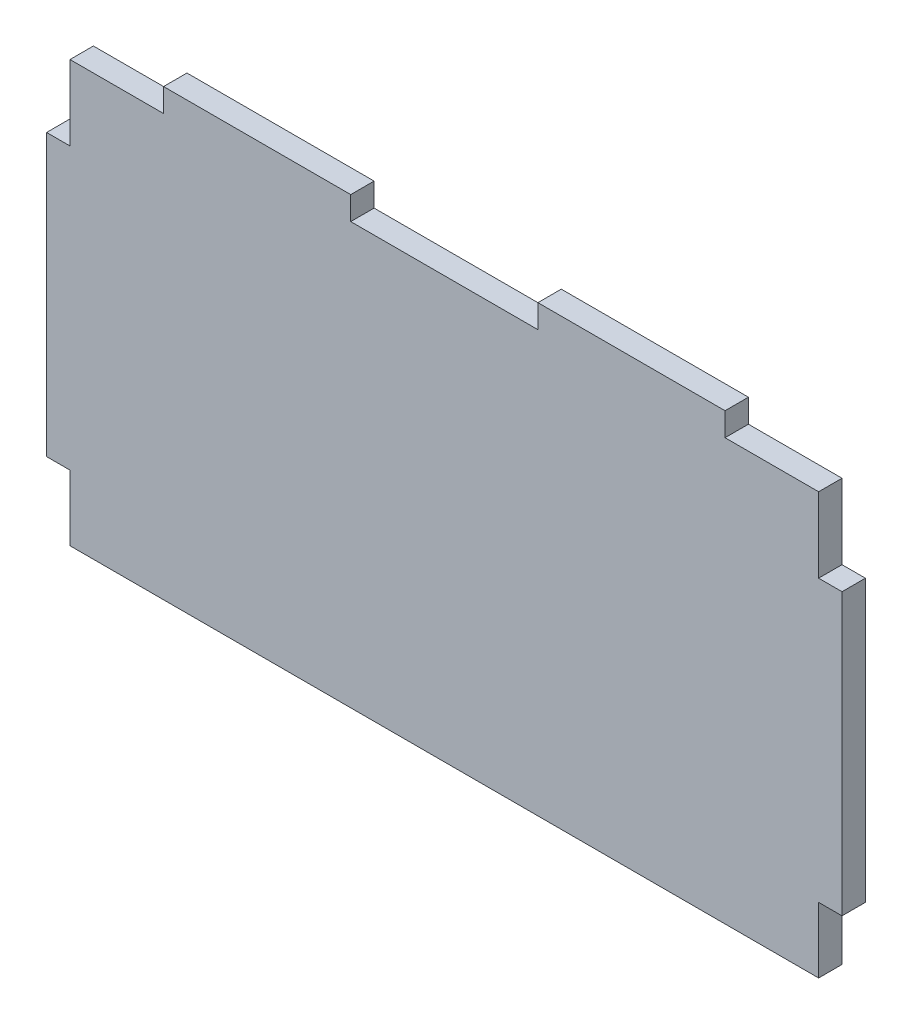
SolidWorks part; units mm, degrees
ref_plane "Front Plane" through (0, 0, 0) normal (0, 0, 1) x (1, 0, 0)
ref_plane "Top Plane" through (0, 0, 0) normal (0, 1, 0) x (1, 0, 0)
ref_plane "Right Plane" through (0, 0, 0) normal (1, 0, 0) x (0, 0, -1)
sketch "Sketch1" plane through (0, 0, 0) normal (0, 0, 1) x (1, 0, 0)
  line L1 (-50.8, 28.575) -> (50.8, 28.575)
  line L2 (-50.8, 28.575) -> (-50.8, -28.575)
  line L3 (-50.8, -28.575) -> (50.8, -28.575)
  line L4 (50.8, 28.575) -> (50.8, -28.575)
  line L5 (-50.8, 28.575) -> (50.8, -28.575) construction
  line L6 (-50.8, -28.575) -> (50.8, 28.575) construction
  point P0 (0, 0)
  dimension "D1" = 101.6
  dimension "D2" = 57.15
extrude "Boss-Extrude1" add sketch "Sketch1" along normal blind 3.175
sketch "Sketch2" plane through (50.8, 0, 0) normal (1, 0, 0) x (0, 0, -1)
  line L0 (-3.175, -28.575) -> (-3.175, 28.575) construction
  line L1 (-3.175, 18.415) -> (0, 18.415)
  line L2 (-3.175, 18.415) -> (-3.175, -19.685)
  line L3 (-3.175, -19.685) -> (0, -19.685)
  line L4 (0, 18.415) -> (0, -19.685)
  line L5 (0, -28.575) -> (0, 28.575) construction
  dimension "D1" = 38.1
  dimension "D2" = 10.16
extrude "Boss-Extrude2" add sketch "Sketch2" along normal blind 3.175
sketch "Sketch3" plane through (-50.8, 0, 0) normal (-1, 0, 0) x (0, 0, 1)
  line L0 (0, 28.575) -> (0, -28.575) construction
  line L1 (0, 18.415) -> (3.175, 18.415)
  line L2 (0, 18.415) -> (0, -19.685)
  line L3 (0, -19.685) -> (3.175, -19.685)
  line L4 (3.175, 18.415) -> (3.175, -19.685)
  line L5 (3.175, 28.575) -> (3.175, -28.575) construction
  dimension "D1" = 38.1
  dimension "D2" = 10.16
extrude "Boss-Extrude3" add sketch "Sketch3" along normal blind 3.175
sketch "Sketch4" plane through (0, 28.575, 0) normal (0, 1, 0) x (1, 0, 0)
  line L0 (50.8, 0) -> (-50.8, 0) construction
  line L1 (12.7, 0) -> (38.1, 0)
  line L2 (12.7, 0) -> (12.7, -3.175)
  line L3 (12.7, -3.175) -> (38.1, -3.175)
  line L4 (38.1, 0) -> (38.1, -3.175)
  line L5 (50.8, -3.175) -> (-50.8, -3.175) construction
  line L6 (0, 0) -> (0, -3.175)
  line L7 (-38.1, 0) -> (-38.1, -3.175)
  line L8 (-12.7, -3.175) -> (-38.1, -3.175)
  line L9 (-12.7, 0) -> (-12.7, -3.175)
  line L10 (-12.7, 0) -> (-38.1, 0)
  dimension "D1" = 12.7
  dimension "D2" = 25.4
extrude "Boss-Extrude5" add sketch "Sketch4" along normal blind 3.175 contours L9 L7 M2 M4 | L4 L2 M2 M4
